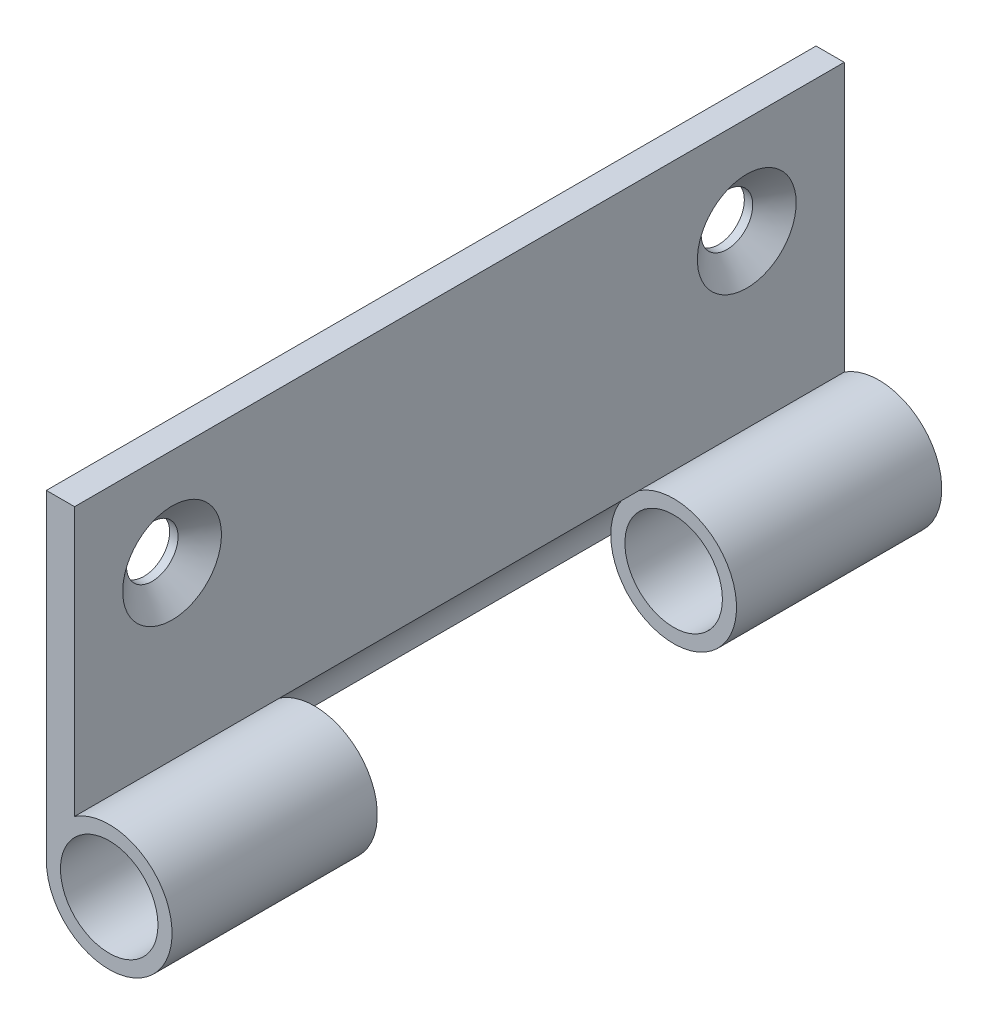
SolidWorks part; units mm, degrees
ref_plane "Front Plane" through (0, 0, 0) normal (0, 0, 1) x (1, 0, 0)
ref_plane "Top Plane" through (0, 0, 0) normal (0, 1, 0) x (1, 0, 0)
ref_plane "Right Plane" through (0, 0, 0) normal (1, 0, 0) x (0, 0, -1)
sketch "Sketch1" plane through (0, 0, 0) normal (1, 0, 0) x (0, 0, -1)
  line L1 (-38.1, 31.75) -> (38.1, 31.75)
  line L2 (-38.1, 31.75) -> (-38.1, 0)
  line L3 (-38.1, 0) -> (38.1, 0)
  line L4 (38.1, 31.75) -> (38.1, 0)
  point P4 (0, 0)
  dimension "D1" = 76.2
  dimension "D2" = 31.75
extrude "Boss-Extrude1" add sketch "Sketch1" along normal blind 2.794 contours L2 L3 L4 L1
sketch "Sketch2" plane through (0, 0, 38.1) normal (0, 0, 1) x (1, 0, 0)
  circle A0 centre (6.223, 0) radius 6.223
  dimension "D1" = 12.446
extrude "Boss-Extrude2" add sketch "Sketch2" against normal up to surface (76.2 mm away)
sketch "Sketch3" plane through (0, 0, 38.1) normal (0, 0, 1) x (1, 0, 0)
  circle A0 centre (6.223, 0) radius 4.826
  dimension "D1" = 9.652
extrude "Cut-Extrude1" cut sketch "Sketch3" against normal through all
sketch "Sketch4" plane through (0, 0, 0) normal (0, 0, 1) x (1, 0, 0)
  circle A0 centre (6.223, 0) radius 6.223
extrude "Cut-Extrude2" cut sketch "Sketch4" against normal mid plane 35.56
sketch "Sketch5" plane through (2.794, 0, 0) normal (1, 0, 0) x (0, 0, -1)
  line L0 (-38.1, 31.75) -> (-38.1, 5.193) construction
  line L1 (-38.1, 31.75) -> (38.1, 31.75) construction
  line L2 (0, 0) -> (0, 51.5426) construction
  line L3 (-17.78, 0) -> (17.78, 0) construction
  point P0 (-28.448, 22.098)
  point P1 (28.448, 22.098)
  dimension "D1" = 9.652
  dimension "D2" = 9.652
hole_wizard "CSK for #10 Flat Head Machine Screw (100)1" positions "Sketch6" profile "Sketch7" countersink size "#10" standard "ANSI Inch"
sketch "Sketch6" plane through (2.794, 0, 0) normal (1, 0, 0) x (0, 0, -1)
  point P0 (28.448, 22.098)
  point P3 (-28.448, 22.098)
sketch "Sketch7" plane through (2.794, 22.098, -28.448) normal (0, 1, 0) x (0, 0, -1)
  line L0 (0, 0) -> (0, 2.794)
  line L1 (0, 2.794) -> (2.5527, 2.794)
  line L2 (2.5527, 2.794) -> (2.5527, 1.9608)
  line L3 (2.5527, 1.9608) -> (4.8895, 0)
  line L5 (4.8895, 0) -> (0, 0)
  line L6 (-2.5527, 1.9608) -> (-4.8895, 0) construction
  line L11 (0, -6.35) -> (0, 107.95) construction
  dimension "Thru Hole Dia." = 5.1054
  dimension "Thru Hole Depth" = 2.794
  dimension "Near C'Sink Dia." = 9.779
  dimension "Near C'Sink Angle" = 100
